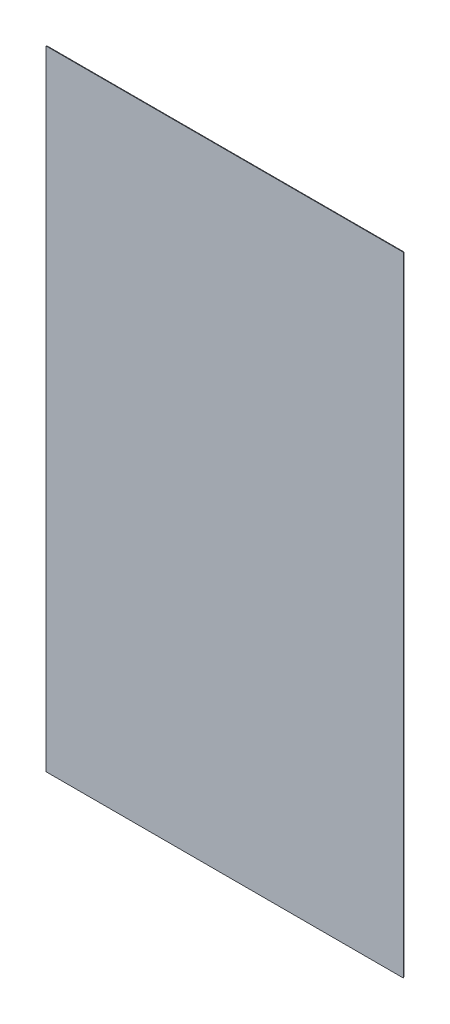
SolidWorks part; units mm, degrees
ref_plane "Plano frontal" through (0, 0, 0) normal (0, 0, 1) x (1, 0, 0)
ref_plane "Plano superior" through (0, 0, 0) normal (0, 1, 0) x (1, 0, 0)
ref_plane "Plano direito" through (0, 0, 0) normal (1, 0, 0) x (0, 0, -1)
sketch "Esboço1" plane through (0, 0, 0) normal (0, 0, 1) x (1, 0, 0)
  line L1 (0, 0) -> (592, 0)
  line L2 (0, 0) -> (0, -1056)
  line L3 (0, -1056) -> (592, -1056)
  line L4 (592, 0) -> (592, -1056)
  dimension "D1" = 1056
  dimension "D2" = 592
extrude "Ressalto-extrusão1" add sketch "Esboço1" along normal blind 6
sketch "Esboço2" plane through (0, 0, 0) normal (-1, 0, 0) x (0, 0, 1)
  line L1 (0, 0) -> (6, 0)
  line L2 (0, 0) -> (0, -1056)
  line L3 (0, -1056) -> (6, -1056)
  line L4 (6, 0) -> (6, -1056)
extrude "Ressalto-extrusão2" add sketch "Esboço2" along normal blind 8
fillet "Filete1" radius 10 3 edges at (-8, -528, 0) (592, -528, 0) (292, 0, 0)
